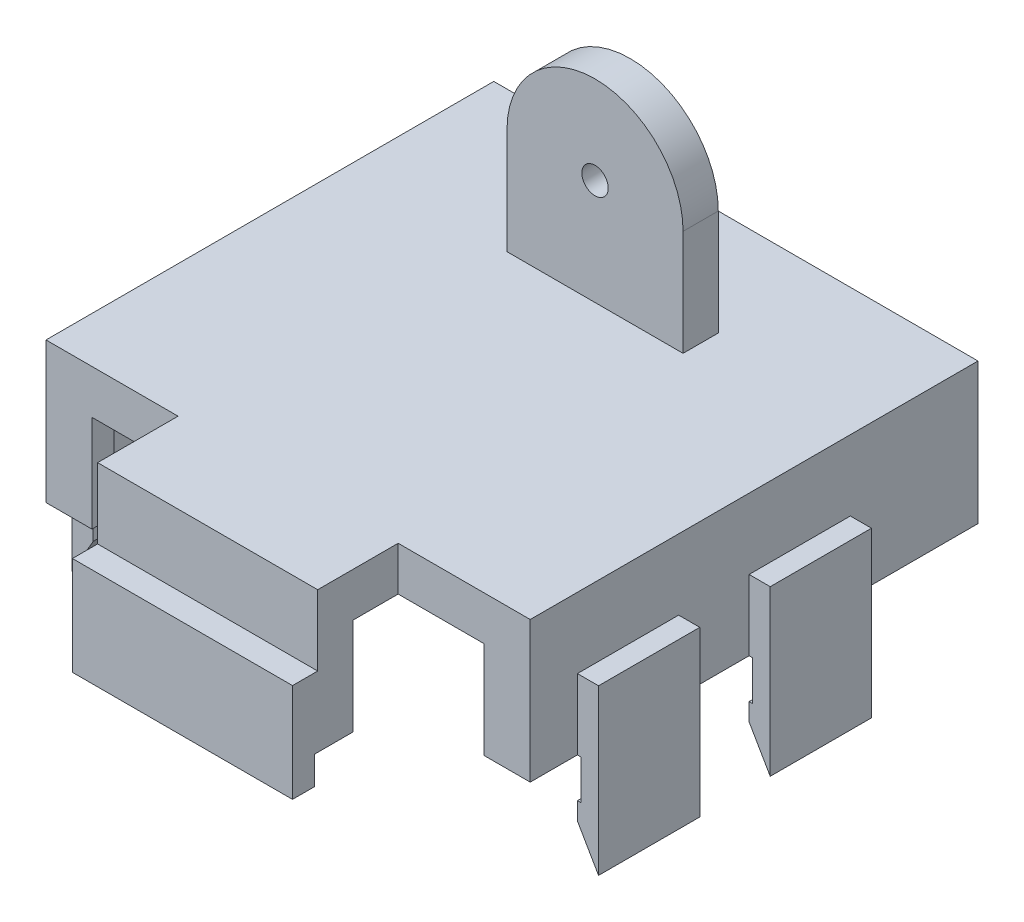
SolidWorks part; units mm, degrees
ref_plane "Front Plane" through (0, 0, 0) normal (0, 0, 1) x (1, 0, 0)
ref_plane "Top Plane" through (0, 0, 0) normal (0, 1, 0) x (1, 0, 0)
ref_plane "Right Plane" through (0, 0, 0) normal (1, 0, 0) x (0, 0, -1)
sketch "Sketch2" plane through (0, 0, 0) normal (0, 1, 0) x (1, 0, 0)
  line L0 (-31.2281, 75.8779) -> (-31.2281, -9.3029) construction
  line L1 (-58.7281, 62.9578) -> (-3.7281, 62.9578)
  line L2 (-58.7281, 62.9578) -> (-58.7281, 2.9578)
  line L3 (-58.7281, 2.9578) -> (-3.7281, 2.9578)
  line L4 (-3.7281, 62.9578) -> (-3.7281, 2.9578)
  line L5 (-75.7274, 32.9578) -> (6.2542, 32.9578) construction
  point P4 (0, 0)
  point P5 (0, 0)
  dimension "D1" = 55
  dimension "D2" = 60
extrude "Boss-Extrude1" add sketch "Sketch2" along normal blind 2.5
sketch "Sketch3" plane through (0, 0, 0) normal (0, -1, 0) x (1, 0, 0)
  line L0 (-58.7281, -2.9578) -> (-3.7281, -2.9578) construction
  line L1 (-3.7281, -2.9578) -> (-3.7281, -62.9578) construction
  line L2 (-3.7281, -62.9578) -> (-58.7281, -62.9578) construction
  line L3 (-58.7281, -62.9578) -> (-58.7281, -2.9578) construction
  line L4 (-58.7281, -2.9578) -> (-3.7281, -2.9578)
  line L5 (-3.7281, -2.9578) -> (-3.7281, -62.9578)
  line L6 (-3.7281, -62.9578) -> (-58.7281, -62.9578)
  line L7 (-58.7281, -62.9578) -> (-58.7281, -2.9578)
  line L8 (-56.2281, -5.4578) -> (-6.2281, -5.4578)
  line L9 (-6.2281, -5.4578) -> (-6.2281, -60.4578)
  line L10 (-6.2281, -60.4578) -> (-56.2281, -60.4578)
  line L11 (-56.2281, -60.4578) -> (-56.2281, -5.4578)
  dimension "D1" = 2.5
extrude "Boss-Extrude2" add sketch "Sketch3" along normal blind 13.5
sketch "Sketch4" plane through (0, 0, -62.9578) normal (0, 0, -1) x (-1, 0, 0)
  line L0 (58.7281, 2.5) -> (58.7281, -13.5) construction
  line L1 (58.7281, -13.5) -> (3.7281, -13.5) construction
  circle A0 centre (43.2281, -13.5) radius 9.5
  circle A1 centre (17.7281, -13.5) radius 9.5
  dimension "D1" = 19
  dimension "D2" = 19
  dimension "D3" = 25.5
  dimension "D4" = 15.5
extrude "Cut-Extrude1" cut sketch "Sketch4" against normal up to surface (2.5 mm away)
sketch "Sketch6" plane through (0, 0, -62.9578) normal (0, 0, -1) x (-1, 0, 0)
  line L0 (58.7281, -5.5) -> (61.1281, -5.5)
  line L1 (58.7281, 2.5) -> (58.7281, -13.5) construction
  line L2 (61.1281, -5.5) -> (61.1281, -24.1569)
  line L3 (58.7281, -18) -> (58.7281, -20)
  line L4 (58.7281, -18) -> (59.1281, -18)
  line L5 (59.1281, -18) -> (59.1281, -13.5)
  line L6 (59.1281, -13.5) -> (58.7281, -13.5)
  line L7 (58.7281, -13.5) -> (58.7281, -5.5)
  line L8 (58.7281, -13.5) -> (58.7281, -29.5) construction
  line L9 (58.7281, -20) -> (61.1281, -24.1569)
  line L10 (31.2281, 2.5) -> (31.2281, -32.7653) construction
  line L11 (52.7281, -13.5) -> (58.7281, -13.5) construction
  line L12 (3.7281, 2.5) -> (58.7281, 2.5) construction
  line L13 (3.7281, -20) -> (1.3281, -24.1569)
  line L14 (3.7281, -13.5) -> (3.7281, -5.5)
  line L15 (3.3281, -13.5) -> (3.7281, -13.5)
  line L16 (3.3281, -18) -> (3.3281, -13.5)
  line L17 (3.7281, -18) -> (3.3281, -18)
  line L18 (3.7281, -18) -> (3.7281, -20)
  line L19 (1.3281, -5.5) -> (1.3281, -24.1569)
  line L20 (3.7281, -5.5) -> (1.3281, -5.5)
  dimension "D1" = 0.4
  dimension "D2" = 2
  dimension "D3" = 8
  dimension "D4" = 30
  dimension "D6" = 2
extrude "Boss-Extrude3" add sketch "Sketch6" against normal up to surface (60 mm away)
sketch "Sketch7" plane through (0, -5.5, 0) normal (0, 1, 0) x (1, 0, 0)
  line L0 (-61.1281, 2.9578) -> (-61.1281, 62.9578) construction
  line L1 (-58.7281, 62.9578) -> (-61.1281, 62.9578)
  line L2 (-58.7281, 62.9578) -> (-58.7281, 48.4578)
  line L3 (-58.7281, 48.4578) -> (-61.1281, 48.4578)
  line L4 (-61.1281, 62.9578) -> (-61.1281, 48.4578)
  line L5 (-58.7281, 62.9578) -> (-58.7281, 2.9578) construction
  line L6 (-58.7281, 36.9578) -> (-61.1281, 36.9578)
  line L7 (-58.7281, 36.9578) -> (-58.7281, 28.9578)
  line L8 (-58.7281, 28.9578) -> (-61.1281, 28.9578)
  line L9 (-61.1281, 36.9578) -> (-61.1281, 28.9578)
  line L10 (-31.2281, 62.9578) -> (-31.2281, -9.2937) construction
  line L11 (-58.7281, 17.4578) -> (-61.1281, 17.4578)
  line L12 (-58.7281, 17.4578) -> (-58.7281, 2.9578)
  line L13 (-58.7281, 2.9578) -> (-61.1281, 2.9578)
  line L14 (-61.1281, 17.4578) -> (-61.1281, 2.9578)
  line L15 (-3.7281, 62.9578) -> (-58.7281, 62.9578) construction
  line L16 (-1.3281, 17.4578) -> (-1.3281, 2.9578)
  line L17 (-3.7281, 2.9578) -> (-1.3281, 2.9578)
  line L18 (-3.7281, 17.4578) -> (-3.7281, 2.9578)
  line L19 (-3.7281, 17.4578) -> (-1.3281, 17.4578)
  line L20 (-1.3281, 36.9578) -> (-1.3281, 28.9578)
  line L21 (-3.7281, 28.9578) -> (-1.3281, 28.9578)
  line L22 (-3.7281, 36.9578) -> (-3.7281, 28.9578)
  line L23 (-3.7281, 36.9578) -> (-1.3281, 36.9578)
  line L24 (-1.3281, 62.9578) -> (-1.3281, 48.4578)
  line L25 (-3.7281, 48.4578) -> (-1.3281, 48.4578)
  line L26 (-3.7281, 62.9578) -> (-3.7281, 48.4578)
  line L27 (-3.7281, 62.9578) -> (-1.3281, 62.9578)
  dimension "D1" = 14.5
  dimension "D2" = 11.5
  dimension "D3" = 8
  dimension "D4" = 11.5
extrude "Cut-Extrude2" cut sketch "Sketch7" against normal through all
sketch "Sketch10" plane through (-58.7281, 0, 0) normal (-1, 0, 0) x (0, 0, 1)
  line L0 (-2.9578, 2.5) -> (-2.9578, -13.5) construction
  line L1 (-2.9578, -5.5) -> (-0.0974, -5.5)
  line L2 (-2.9578, -5.5) -> (-2.9578, -13.5)
  line L3 (-2.5688, -16.6967) -> (-0.0974, -16.6967)
  line L4 (-0.0974, -5.5) -> (-0.0974, -16.6967)
  line L6 (-2.9578, -13.5) -> (-2.5688, -13.5)
  line L9 (-2.5688, -13.5) -> (-2.5688, -16.6967)
  dimension "D1" = 2.8604
  dimension "D2" = 2.4713
  dimension "D3" = 11.1967
extrude "Boss-Extrude4" add sketch "Sketch10" against normal up to surface (55 mm away)
sketch "Sketch11" plane through (0, -5.5, 0) normal (0, 1, 0) x (1, 0, 0)
  line L0 (-31.2281, 0.0974) -> (-31.2281, 54.7318) construction
  line L1 (-3.7281, 0.0974) -> (-18.7281, 0.0974)
  line L2 (-3.7281, 0.0974) -> (-3.7281, 12.0974)
  line L3 (-3.7281, 12.0974) -> (-18.7281, 12.0974)
  line L4 (-18.7281, 0.0974) -> (-18.7281, 12.0974)
  line L5 (-3.7281, 0.0974) -> (-58.7281, 0.0974) construction
  line L6 (-43.7281, 0.0974) -> (-43.7281, 12.0974)
  line L7 (-58.7281, 12.0974) -> (-43.7281, 12.0974)
  line L8 (-58.7281, 0.0974) -> (-58.7281, 12.0974)
  line L9 (-58.7281, 0.0974) -> (-43.7281, 0.0974)
  dimension "D1" = 15
  dimension "D2" = 12
sketch "Sketch12" plane through (0, 0, -62.9578) normal (0, 0, -1) x (-1, 0, 0)
  line L0 (31.2281, 17.9453) -> (31.2281, -10.4224) construction
  line L1 (3.7281, 2.5) -> (58.7281, 2.5) construction
  line L2 (41.2281, 2.5) -> (21.2281, 2.5)
  line L3 (41.2281, 2.5) -> (41.2281, 14.5)
  line L5 (21.2281, 2.5) -> (21.2281, 14.5)
  line L6 (3.7281, 2.5) -> (3.7281, -13.5) construction
  line L7 (58.7281, 2.5) -> (58.7281, -13.5) construction
  arc A0 (41.2281, 14.5) -> (21.2281, 14.5) centre (31.2281, 14.5) ccw
  circle A1 centre (31.2281, 14.5) radius 1.5
  dimension "D2" = 12
  dimension "D3" = 3
  dimension "D1" = 20
extrude "Boss-Extrude5" add sketch "Sketch12" against normal blind 16
sketch "Sketch13" plane through (-21.2281, 0, 0) normal (1, 0, 0) x (0, 0, -1)
  line L0 (62.9578, 24.5) -> (46.9578, 24.5) construction
  line L1 (62.9578, 2.5) -> (50.9578, 2.5)
  line L2 (62.9578, 2.5) -> (62.9578, 24.5)
  line L3 (62.9578, 24.5) -> (50.9578, 24.5)
  line L4 (50.9578, 2.5) -> (50.9578, 24.5)
  dimension "D1" = 12
extrude "Cut-Extrude4" cut sketch "Sketch13" against normal through all
extrude "Cut-Extrude5" cut sketch "Sketch11" along normal through all and the other way through all
sketch "Sketch14" plane through (-56.2281, 0, 0) normal (1, 0, 0) x (0, 0, -1)
  line L1 (12.0974, -13.5) -> (14.5974, -13.5)
  line L2 (12.0974, -13.5) -> (12.0974, 0)
  line L3 (12.0974, 0) -> (14.5974, 0)
  line L4 (14.5974, -13.5) -> (14.5974, 0)
  dimension "D1" = 2.5
extrude "Boss-Extrude6" add sketch "Sketch14" along normal offset from surface (15 mm away) 2.5
sketch "Sketch15" plane through (0, 0, -12.0974) normal (0, 0, 1) x (1, 0, 0)
  line L1 (-43.7281, 0) -> (-41.2281, 0)
  line L2 (-43.7281, 0) -> (-43.7281, -13.5)
  line L3 (-43.7281, -13.5) -> (-41.2281, -13.5)
  line L4 (-41.2281, 0) -> (-41.2281, -13.5)
extrude "Boss-Extrude7" add sketch "Sketch15" along normal up to surface (6.6396 mm away)
sketch "Sketch16" plane through (-6.2281, 0, 0) normal (-1, 0, 0) x (0, 0, 1)
  line L1 (-12.0974, -13.5) -> (-14.5974, -13.5)
  line L2 (-12.0974, -13.5) -> (-12.0974, 0)
  line L3 (-12.0974, 0) -> (-14.5974, 0)
  line L4 (-14.5974, -13.5) -> (-14.5974, 0)
  dimension "D1" = 2.5
extrude "Boss-Extrude9" add sketch "Sketch16" along normal offset from surface (15 mm away) 2.5
sketch "Sketch17" plane through (0, 0, -12.0974) normal (0, 0, 1) x (1, 0, 0)
  line L1 (-18.7281, 0) -> (-21.2281, 0)
  line L2 (-18.7281, 0) -> (-18.7281, -13.5)
  line L3 (-18.7281, -13.5) -> (-21.2281, -13.5)
  line L4 (-21.2281, 0) -> (-21.2281, -13.5)
extrude "Boss-Extrude10" add sketch "Sketch17" along normal up to surface (6.6396 mm away)
sketch "Sketch18" plane through (0, -13.5, 0) normal (0, -1, 0) x (1, 0, 0)
  line L0 (-31.2281, 4.769) -> (-31.2281, -28.9157) construction
  line L1 (-53.5059, -6.9832) -> (-8.9503, -6.9832)
  line L2 (-53.5059, -6.9832) -> (-53.5059, -21.413)
  line L3 (-53.5059, -21.413) -> (-8.9503, -21.413)
  line L4 (-8.9503, -6.9832) -> (-8.9503, -21.413)
  line L5 (-43.7281, -12.0974) -> (-43.7281, -2.5688) construction
  line L6 (-18.7281, -2.5688) -> (-18.7281, -12.0974) construction
extrude "Cut-Extrude6" cut sketch "Sketch18" against normal blind 11
ref_plane "Plane1" through (-31.2281, 0, 0) normal (-1, 0, 0) x (0, 0, 1)
